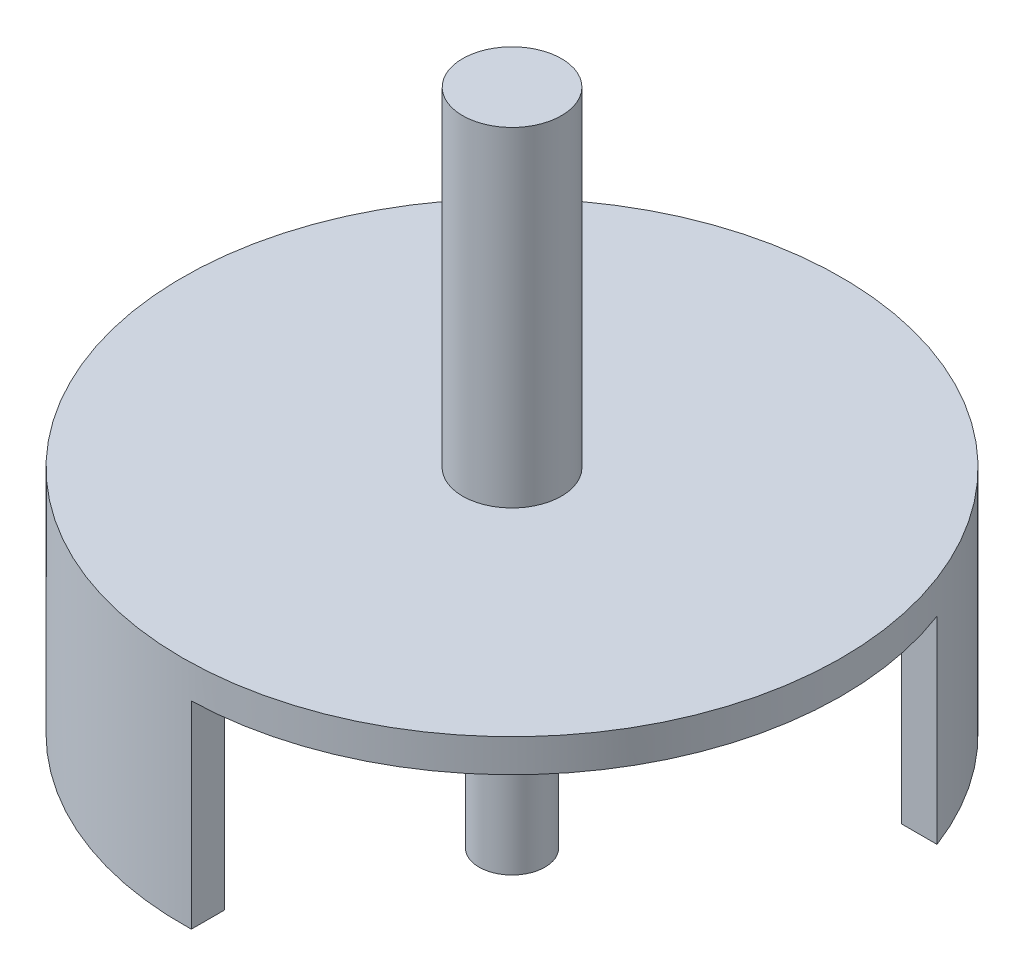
SolidWorks part; units mm, degrees
ref_plane "Front Plane" through (0, 0, 0) normal (0, 0, 1) x (1, 0, 0)
ref_plane "Top Plane" through (0, 0, 0) normal (0, 1, 0) x (1, 0, 0)
ref_plane "Right Plane" through (0, 0, 0) normal (1, 0, 0) x (0, 0, -1)
sketch "Sketch1" plane through (0, 0, 0) normal (0, 1, 0) x (1, 0, 0)
  circle A0 centre (0, 0) radius 10
extrude "Boss-Extrude1" add sketch "Sketch1" along normal blind 7
sketch "Sketch2" plane through (0, 0, 0) normal (0, -1, 0) x (1, 0, 0)
  circle A0 centre (0, 0) radius 9
extrude "Cut-Extrude1" cut sketch "Sketch2" against normal blind 6
sketch3d "3DSketch1"
  line L0 (11.0806, 0, 0.3225) -> (8.7648, 0, 10.5236)
  line L2 (11.0806, 0, 0.3225) -> (0.2638, 0, 0.3225)
  line L3 (0.2638, 0, 0.3225) -> (0.2638, 0, 10.5236)
  line L4 (8.7648, 0, 10.5236) -> (0.2638, 0, 10.5236)
extrude "Cut-Extrude5" cut sketch "3DSketch1" along direction (0, -1, 0) on the side against the normal blind 6
sketch "Sketch3" plane through (0, 7, 0) normal (0, 1, 0) x (-1, 0, 0)
  circle A0 centre (0, 0) radius 1
extrude "Boss-Extrude2" add sketch "Sketch3" against normal blind 10 from surface at 0
sketch "Sketch4" plane through (0, 7, 0) normal (0, 1, 0) x (-1, 0, 0)
  circle A0 centre (0, 0) radius 1.5
extrude "Boss-Extrude3" add sketch "Sketch4" along normal blind 10
sketch "Sketch5" plane through (0, 0, 0) normal (0, -1, 0) x (1, 0, 0)
  line L1 (7.8268, 1.4071) -> (11.1099, 1.4071)
  line L2 (7.8268, 1.4071) -> (7.8268, -3.547)
  line L3 (7.8268, -3.547) -> (11.1099, -3.547)
  line L4 (11.1099, 1.4071) -> (11.1099, -3.547)
extrude "Cut-Extrude6" cut sketch "Sketch5" against normal blind 6
